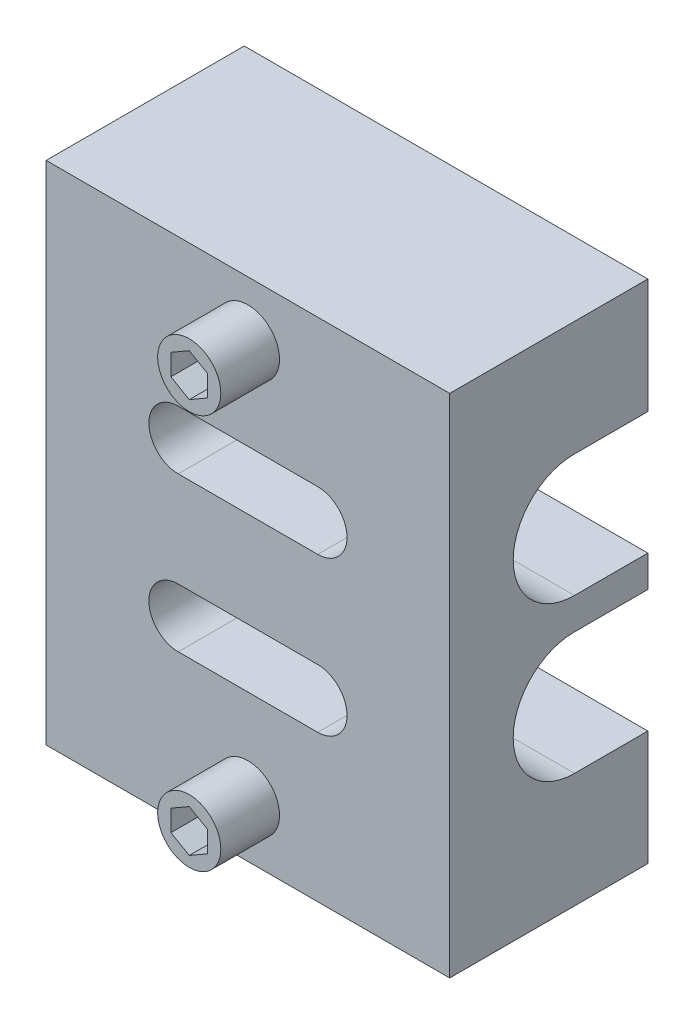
SolidWorks part; units mm, degrees
ref_plane "Front Plane" through (0, 0, 0) normal (0, 0, 1) x (1, 0, 0)
ref_plane "Top Plane" through (0, 0, 0) normal (0, 1, 0) x (1, 0, 0)
ref_plane "Right Plane" through (0, 0, 0) normal (1, 0, 0) x (0, 0, -1)
sketch "Sketch1" plane through (0, 0, 0) normal (0, 0, 1) x (1, 0, 0)
  line L0 (-6.985, -8.763) -> (6.985, -8.763)
  line L1 (6.985, -8.763) -> (6.985, 8.763)
  line L2 (6.985, 8.763) -> (-6.985, 8.763)
  line L3 (-6.985, 8.763) -> (-6.985, -8.763)
  line L4 (-6.985, 8.763) -> (6.985, -8.763) construction
  dimension "D1" = 17.526
  dimension "D2" = 13.97
extrude "Extrude1" add sketch "Sketch1" along normal blind 6.858
sketch "Sketch3" plane through (0, 0, 6.858) normal (0, 0, 1) x (1, 0, 0)
  line L0 (-2.413, -3.683) -> (2.413, -3.683)
  line L1 (2.413, -1.651) -> (-2.413, -1.651)
  line L2 (-6.985, -8.763) -> (6.985, -8.763) construction
  line L3 (-6.985, 8.763) -> (-6.985, -8.763) construction
  line L4 (2.413, 3.683) -> (-2.413, 3.683)
  line L5 (-2.413, 1.651) -> (2.413, 1.651)
  arc A0 (-2.413, -1.651) -> (-2.413, -3.683) centre (-2.413, -2.667) ccw
  arc A1 (2.413, -3.683) -> (2.413, -1.651) centre (2.413, -2.667) ccw
  arc A3 (-2.413, 3.683) -> (-2.413, 1.651) centre (-2.413, 2.667) ccw
  arc A4 (2.413, 1.651) -> (2.413, 3.683) centre (2.413, 2.667) ccw
  point P8 (0, -3.683)
  point P13 (0, -8.763)
  dimension "D1" = 4.826
  dimension "D2" = 1.016
  dimension "D3" = 2.667
  dimension "D5" = 2
  dimension "D6" = 5.334
  dimension "D4" = 6.985
extrude "Cut-Extrude2" cut sketch "Sketch3" against normal blind 6.858
sketch "Sketch4" plane through (0, 0, 6.858) normal (0, 0, 1) x (1, 0, 0)
  line L0 (6.985, 8.763) -> (-6.985, 8.763) construction
  line L1 (-6.985, -8.763) -> (6.985, -8.763) construction
  circle A0 centre (0, 6.8326) radius 1.0922
  circle A1 centre (0, -6.8326) radius 1.0922
  point P4 (0, 8.763)
  dimension "D1" = 2.1844
  dimension "D2" = 1.9304
  dimension "D3" = 1.9304
extrude "Extrude2" add sketch "Sketch4" along normal blind 2.032
sketch "Sketch6" plane through (0, 0, 8.89) normal (0, 0, 1) x (1, 0, 0)
  line L1 (0, 7.5658) -> (-0.635, 7.1992)
  line L2 (-0.635, 7.1992) -> (-0.635, 6.466)
  line L3 (-0.635, 6.466) -> (0, 6.0994)
  line L4 (0, 6.0994) -> (0.635, 6.466)
  line L5 (0.635, 6.466) -> (0.635, 7.1992)
  line L6 (0.635, 7.1992) -> (0, 7.5658)
  line L7 (0, -6.0994) -> (-0.635, -6.466)
  line L8 (-0.635, -6.466) -> (-0.635, -7.1992)
  line L9 (-0.635, -7.1992) -> (0, -7.5658)
  line L10 (0, -7.5658) -> (0.635, -7.1992)
  line L11 (0.635, -7.1992) -> (0.635, -6.466)
  line L12 (0.635, -6.466) -> (0, -6.0994)
  circle A0 centre (0, 6.8326) radius 0.635 construction
  circle A1 centre (0, -6.8326) radius 0.635 construction
  dimension "D1" = 1.27
extrude "Cut-Extrude3" cut sketch "Sketch6" against normal blind 1.016
sketch "Sketch8" plane through (6.985, 0, 0) normal (1, 0, 0) x (0, 0, -1)
  line L0 (-2.54, 0.5461) -> (0, 0.5461)
  line L1 (0, 0.5461) -> (0, 4.7879)
  line L2 (0, 4.7879) -> (-2.54, 4.7879)
  line L3 (0, -8.763) -> (0, 8.763) construction
  line L5 (-2.54, -4.7879) -> (0, -4.7879)
  line L6 (0, -0.5461) -> (-2.54, -0.5461)
  line L7 (0, -4.7879) -> (0, -0.5461)
  arc A0 (-2.54, 4.7879) -> (-2.54, 0.5461) centre (-2.54, 2.667) ccw
  arc A1 (-2.54, -0.5461) -> (-2.54, -4.7879) centre (-2.54, -2.667) ccw
  dimension "D1" = 2.1209
  dimension "D2" = 2.667
  dimension "D3" = 2.54
  dimension "D5" = 5.334
  dimension "D4" = 2
extrude "Cut-Extrude5" cut sketch "Sketch8" against normal through all
